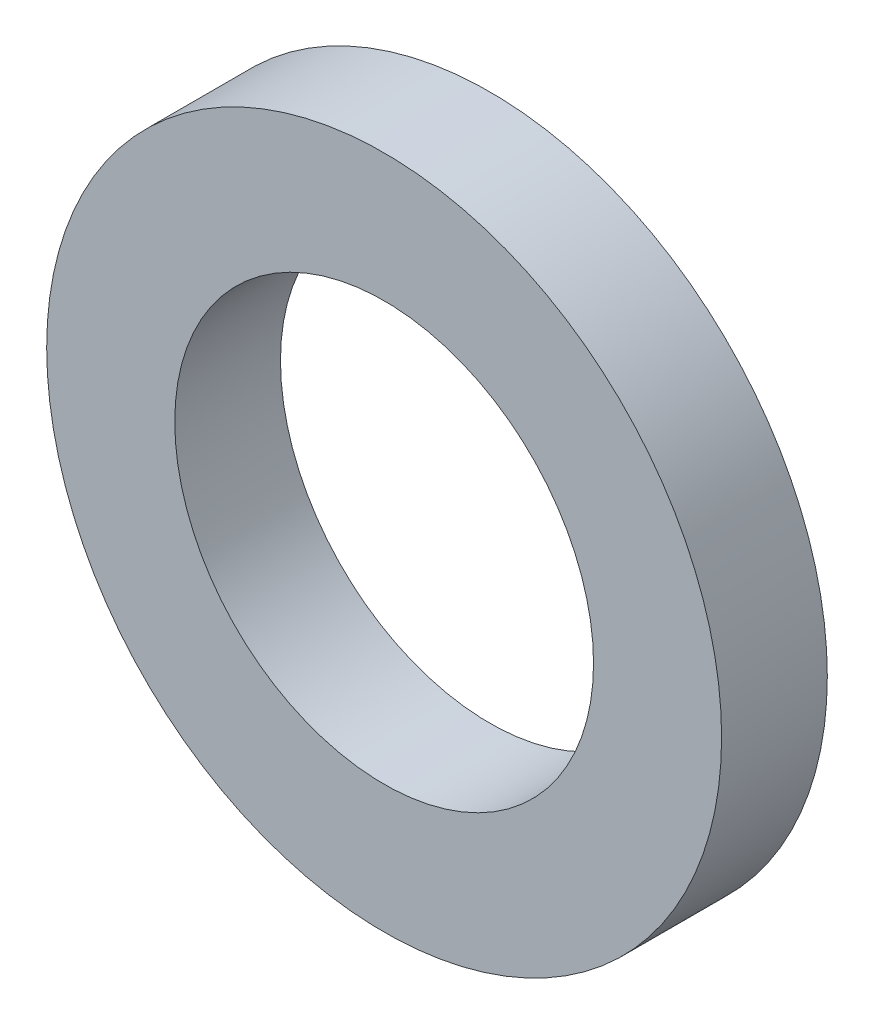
SolidWorks part; units mm, degrees
ref_plane "Plan de face" through (0, 0, 0) normal (0, 0, 1) x (1, 0, 0)
ref_plane "Plan de dessus" through (0, 0, 0) normal (0, 1, 0) x (1, 0, 0)
ref_plane "Plan de droite" through (0, 0, 0) normal (1, 0, 0) x (0, 0, -1)
sketch "Esquisse1" plane through (0, 0, 0) normal (0, 0, 1) x (1, 0, 0)
  circle A0 centre (0, 0) radius 5.15
  circle A1 centre (0, 0) radius 8.3
  dimension "D1" = 10.3
  dimension "D2" = 16.6
extrude "Extrusion1" add sketch "Esquisse1" along normal blind 2.6
